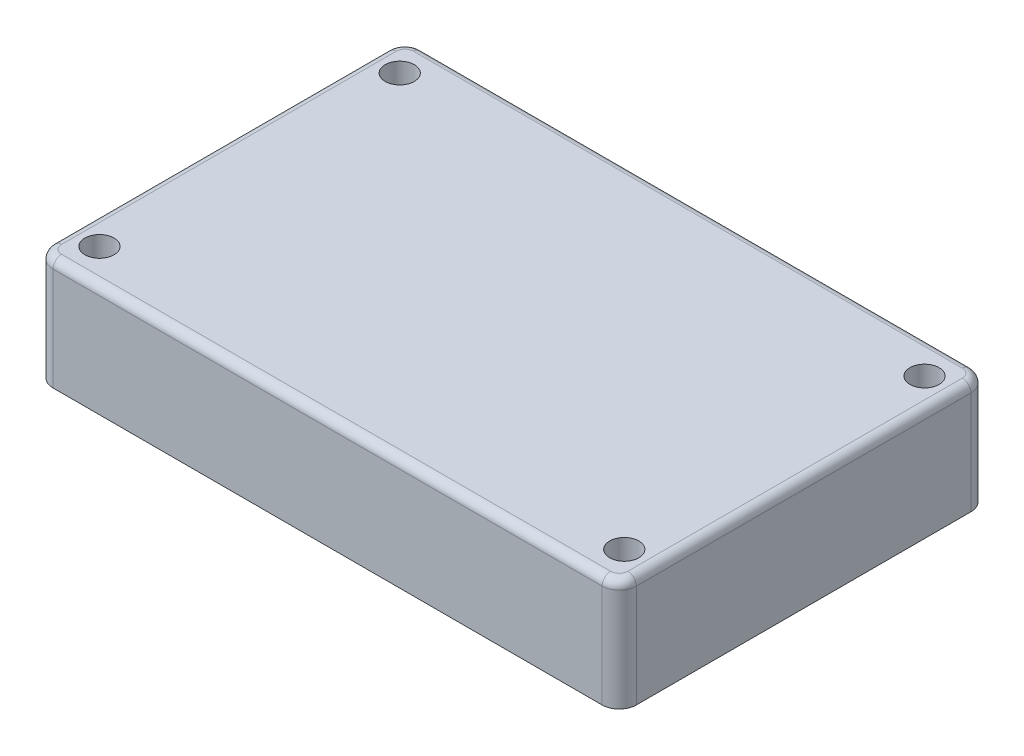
SolidWorks part; units mm, degrees
ref_plane "Front Plane" through (0, 0, 0) normal (0, 0, 1) x (1, 0, 0)
ref_plane "Top Plane" through (0, 0, 0) normal (0, 1, 0) x (1, 0, 0)
ref_plane "Right Plane" through (0, 0, 0) normal (1, 0, 0) x (0, 0, -1)
ref_plane "Gasket_offset" through (0, 1.6, 0) normal (0, 1, 0) x (1, 0, 0)
sketch "Sketch1" plane through (0, 0, 0) normal (0, 1, 0) x (1, 0, 0)
  line L17 (34, -21.5) -> (-34, -21.5)
  line L18 (34, -21.5) -> (34, 21.5)
  line L19 (34, 21.5) -> (-34, 21.5)
  line L20 (-34, -21.5) -> (-34, 21.5)
  line L21 (34, -21.5) -> (-34, 21.5) construction
  line L22 (34, 21.5) -> (-34, -21.5) construction
  point P3 (0, 0)
  dimension "D1" = 68
  dimension "D2" = 43
extrude "Boss-Extrude1" add sketch "Sketch1" along normal blind 13 from surface at 1.6
shell "Shell1" thickness 4
fillet "Fillet1" [suppressed] radius 7
sketch "Sketch2" plane through (0, 12.2, 0) normal (0, -1, 0) x (1, 0, 0)
  line L4 (30, 17.5) -> (-30, 17.5)
  line L5 (-30, 17.5) -> (-30, -17.5)
  line L6 (-30, -17.5) -> (30, -17.5)
  line L7 (30, -17.5) -> (30, 17.5)
  line L8 (30, 17.5) -> (-30, 17.5)
  line L9 (-30, 17.5) -> (-30, -17.5)
  line L10 (-30, -17.5) -> (30, -17.5)
  line L11 (30, -17.5) -> (30, 17.5)
  dimension "D1" = 0
chamfer "Chamfer2" distance 2 angle 75 4 edges at (-30, 6.9, 17.5) (-30, 6.9, -17.5) (30, 6.9, -17.5) (30, 6.9, 17.5)
sketch "Sketch5" plane through (0, 1.6, 0) normal (0, -1, 0) x (1, 0, 0)
  line L0 (31, 2) -> (31, -2) construction
  line L1 (34, 2) -> (34, -2)
  line L2 (28, 2) -> (28, -2)
  circle A0 centre (31, 0) radius 1 construction
  circle A1 centre (31, 0) radius 3 construction
  arc A2 (34, 2) -> (28, 2) centre (31, 2) ccw
  arc A3 (28, -2) -> (34, -2) centre (31, -2) ccw
  point P4 (31, 0)
  dimension "D1" = 2
  dimension "D2" = 6
  dimension "D3" = 31
  dimension "D4" = 4
extrude "Boss-Extrude2" add sketch "Sketch5" against normal up to surface (10.6 mm away)
fillet "Fillet3" radius 2 10 edges at (-28, 6.9, 17.5) (-30, 6.9, 10.0359) (-30, 6.9, -10.0359) (-28, 6.9, -17.5) (30, 6.9, 10.0359) (28, 6.9, 17.5) (28, 6.9, -17.5) (30, 6.9, -10.0359) (30, 6.9, -4.8284) (30, 6.9, 4.8284)
fillet "Fillet4" radius 2 4 edges at (-34, 8.1, -21.5) (-34, 8.1, 21.5) (34, 8.1, -21.5) (34, 8.1, 21.5)
sketch "Sketch6" plane through (0, 1.6, 0) normal (0, -1, 0) x (1, 0, 0)
  line L0 (31, -2) -> (31, 2) construction
  line L1 (30, -2) -> (30, 2)
  line L2 (32, -2) -> (32, 2)
  circle A0 centre (31, 0) radius 1 construction
  arc A1 (30, -2) -> (32, -2) centre (31, -2) ccw
  arc A2 (32, 2) -> (30, 2) centre (31, 2) ccw
  point P4 (31, 0)
  dimension "D2" = 2
  dimension "D1" = 31
  dimension "D3" = 4
sketch "Sketch9" plane through (0, 0, 0) normal (0, 0, 1) x (1, 0, 0)
  line L0 (31, 1.6) -> (27, 8.5282)
  line L1 (55, 0) -> (-55, 0) construction
  dimension "D1" = 60
  dimension "D2" = 8
hole_wizard "M3 Clearance Hole1" positions "Sketch7" profile "Sketch8" hole size "M3" standard "ISO"
sketch "Sketch7" plane through (0, 14.6, 0) normal (0, 1, 0) x (1, 0, 0)
  point P12 (30.5885, 17.5)
  point P15 (-30.5885, 17.5)
  point P18 (30.5885, -17.5)
  point P21 (-30.5885, -17.5)
sketch "Sketch8" plane through (30.5885, 14.6, -17.5) normal (1, 0, 0) x (0, 0, 1)
  line L0 (0, 0) -> (0, 13)
  line L1 (0, 13) -> (1.7, 13)
  line L2 (1.7, 13) -> (1.7, 0)
  line L5 (1.7, 0) -> (0, 0)
  line L11 (0, -6.35) -> (0, 107.95) construction
  dimension "Thru Hole Dia." = 3.4
  dimension "Thru Hole Depth" = 13
sweep "Cut-Sweep1" cut profiles "Sketch6" path "Sketch9"
fillet "Fillet5" radius 1 8 edges at (33.4142, 14.6, 20.9142) (34, 14.6, 0) (33.4142, 14.6, -20.9142) (0, 14.6, -21.5) (-33.4142, 14.6, -20.9142) (-34, 14.6, 0) (-33.4142, 14.6, 20.9142) (0, 14.6, 21.5)
